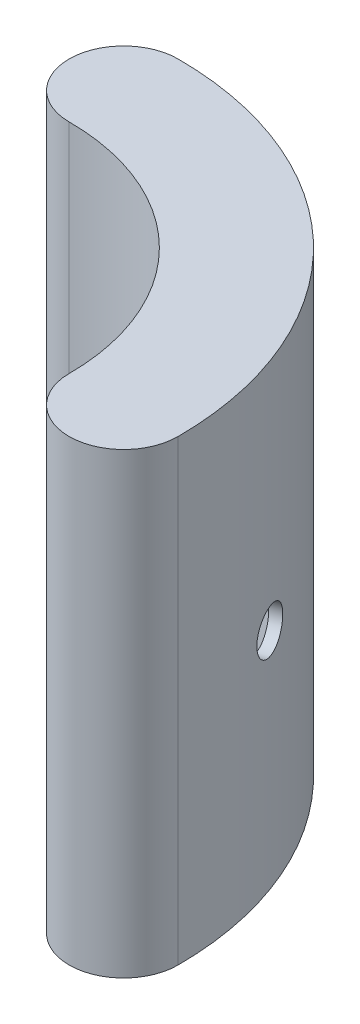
SolidWorks part; units mm, degrees
ref_plane "Front Plane" through (0, 0, 0) normal (0, 0, 1) x (1, 0, 0)
ref_plane "Top Plane" through (0, 0, 0) normal (0, 1, 0) x (1, 0, 0)
ref_plane "Right Plane" through (0, 0, 0) normal (1, 0, 0) x (0, 0, -1)
sketch "Sketch1" plane through (0, 0, 0) normal (0, 1, 0) x (1, 0, 0)
  arc A0 (0, 76.2) -> (76.2, 0) centre (0, 0) cw
  arc A1 (0, 50.8) -> (50.8, 0) centre (0, 0) cw
  arc A2 (0, 76.2) -> (0, 50.8) centre (0, 63.5) ccw
  arc A3 (50.8, 0) -> (76.2, 0) centre (63.5, 0) ccw
  arc A4 (0, 73.66) -> (73.66, 0) centre (0, 0) cw
  arc A5 (0, 73.66) -> (0, 53.34) centre (0, 63.5) ccw
  arc A6 (0, 53.34) -> (53.34, 0) centre (0, 0) cw
  arc A7 (53.34, 0) -> (73.66, 0) centre (63.5, 0) ccw
  arc A8 (0, 73.66) -> (0, 53.34) centre (0, 63.5) ccw construction
  arc A9 (53.34, 0) -> (73.66, 0) centre (63.5, 0) ccw construction
  dimension "D1" = 25.4
  dimension "D2" = 2.54
extrude "Extrude1" add sketch "Sketch1" along normal blind 101.6
sketch "Sketch2" plane through (0, 101.6, 0) normal (0, 1, 0) x (-1, 0, 0)
  arc A0 (-76.2, 0) -> (0, -76.2) centre (0, 0) ccw
  arc A1 (-50.8, 0) -> (0, -50.8) centre (0, 0) ccw
  arc A2 (-50.8, 0) -> (-76.2, 0) centre (-63.5, 0) ccw
  arc A3 (0, -76.2) -> (0, -50.8) centre (0, -63.5) ccw
extrude "Extrude6" add sketch "Sketch2" along normal blind 2.54
sketch "Sketch3" plane through (0, 0, 0) normal (0, -1, 0) x (1, 0, 0)
  arc A0 (0, -50.8) -> (50.8, 0) centre (0, 0) ccw
  arc A1 (0, -76.2) -> (76.2, 0) centre (0, 0) ccw
  arc A2 (76.2, 0) -> (50.8, 0) centre (63.5, 0) ccw
  arc A3 (0, -50.8) -> (0, -76.2) centre (0, -63.5) ccw
extrude "Extrude7" add sketch "Sketch3" along normal blind 2.54
sketch "Sketch4" plane through (73.7655, 0, -27.0709) normal (0.9388, 0, -0.3445) x (-0.3445, 0, -0.9388)
  circle A0 centre (0, 49.53) radius 5.08
  dimension "D1" = 10.16
extrude "Cut-Extrude1" cut sketch "Sketch4" against normal blind 7.62
sketch "Sketch5" plane through (26.2139, 0, -74.0744) normal (0.3336, 0, -0.9427) x (-0.9427, 0, -0.3336)
  circle A0 centre (0, 49.53) radius 3.175
  dimension "D1" = 6.35
extrude "Cut-Extrude2" cut sketch "Sketch5" against normal blind 7.62
